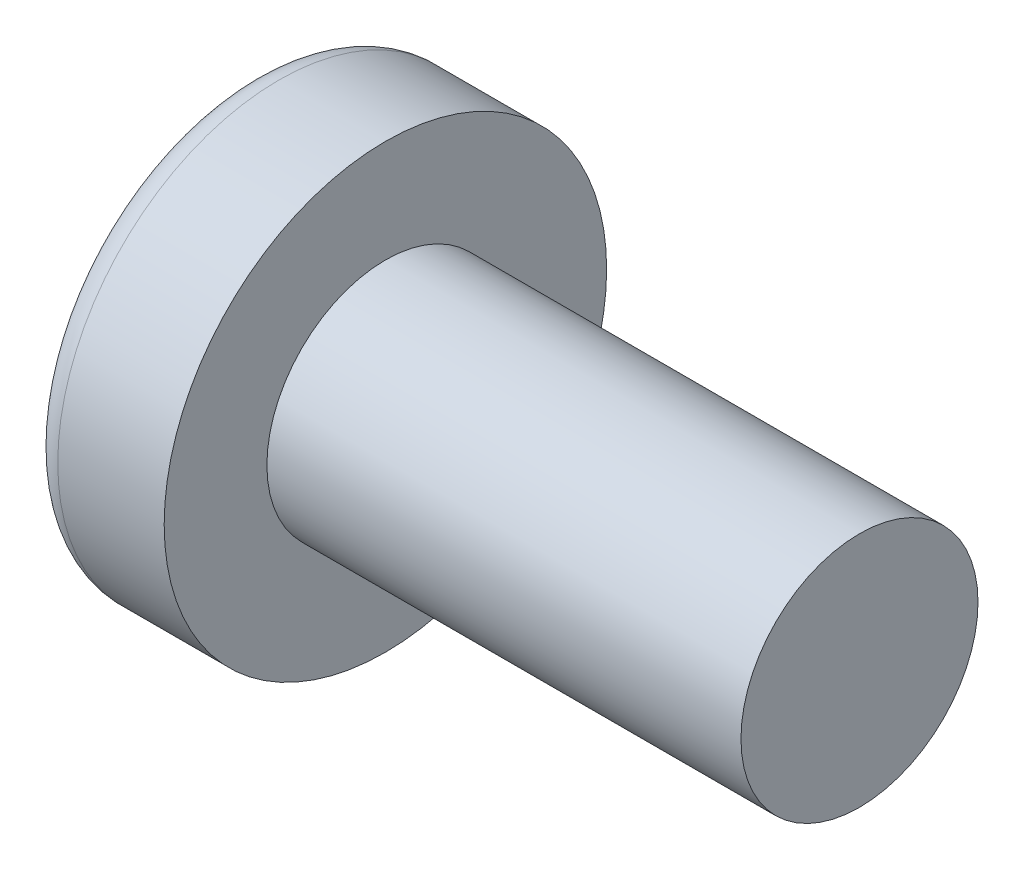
SolidWorks part; units mm, degrees
ref_plane "Plane1" through (0, 0, 0) normal (0, 0, 1) x (1, 0, 0)
ref_plane "Plane2" through (0, 0, 0) normal (0, 1, 0) x (1, 0, 0)
ref_plane "Plane3" through (0, 0, 0) normal (1, 0, 0) x (0, 0, -1)
revolve "Base-Revolve" add sketch "BodySke" angle 360 about L2
sketch "BodySke" plane through (0, 0, 0) normal (0, 0, 1) x (1, 0, 0)
  line L0 (2.4, 1.5) -> (2.4, 2.8)
  line L1 (2.9, 6.35) -> (2.9, -3.175) construction
  line L2 (-25.4, 0) -> (127, 0) construction
  line L3 (8.4, 0) -> (0, 0)
  line L4 (2.4, 1.5) -> (8.4, 1.5)
  line L5 (8.4, 1.5) -> (8.4, 0)
  line L6 (1.0534, 2.8) -> (2.4, 2.8)
  line L7 (2.4, -1.5) -> (8.4, -1.5) construction
  line L8 (2.4, 6.35) -> (2.4, -3.175) construction
  arc A0 (0.7472, 2.6293) -> (0, 0) centre (5, 0) ccw
  arc A2 (0.7472, 2.6293) -> (1.0534, 2.8) centre (1.0534, 2.44) cw
  dimension "Head_fillet_rad" = 0.36
  dimension "Head_crown_rad" = 5
  dimension "Head_ht" = 2.4
  dimension "Diameter" = 3
  dimension "Length" = 6
  dimension "Head_dia" = 5.6
  dimension "Advance" = 0.5
  dimension "Thread_nom" = 6
sketch "Sketch3" plane through (0, 0, 0) normal (1, 0, 0) x (0, 0, -1)
  line L0 (0.37, -1.45) -> (-0.37, -1.45)
  line L1 (0.37, -1.45) -> (0.37, 1.45)
  line L2 (-0.37, 1.45) -> (0.37, 1.45)
  line L3 (-0.37, 1.45) -> (-0.37, -1.45)
  dimension "D1" = 1.45
  dimension "Cross_dia" = 2.9
  dimension "D2" = 0.37
  dimension "Cross_width" = 0.74
ref_plane "Plane4" through (1.76, 0, 0) normal (1, 0, 0) x (0, 0, -1)
sketch "Sketch4" plane through (1.76, 0, 0) normal (1, 0, 0) x (0, 0, -1)
  line L0 (0.185, -0.185) -> (-0.185, -0.185)
  line L1 (0.185, -0.185) -> (0.185, 0.185)
  line L2 (-0.185, 0.185) -> (0.185, 0.185)
  line L3 (-0.185, 0.185) -> (-0.185, -0.185)
  dimension "D1" = 0.37
  dimension "D2" = 0.37
  dimension "D3" = 0.185
  dimension "D4" = 0.185
loft "Cut-Loft1" cut profiles "Sketch3", "Sketch4"
pattern_circular "CirPattern1" count 2 every 90 about axis through (0, 0, 0) along (1, 0, 0) of "Cut-Loft1"
equation "\"D1@Sketch3\" = \"Cross_dia@Sketch3\" / 2"
equation "\"D2@Sketch3\" = \"Cross_width@Sketch3\" / 2"
equation "\"D1@Sketch4\" = \"Cross_width@Sketch3\" *.5"
equation "\"D2@Sketch4\" = \"D1@Sketch4\""
equation "\"D3@Sketch4\" = \"D1@Sketch4\" / 2"
equation "\"D4@Sketch4\" = \"D2@Sketch4\" / 2"
equation "\"Thread_length@ThreadCosmetic\" = ((sgn( (\"Length@BodySke\" - \"Advance@BodySke\" ) - \"Thread_nom@BodySke\" )-1)*( (\"Length@BodySke\" - \"Advance@BodySke\" ) - \"Thread_nom@BodySke\" ))/-2+ \"Thread_nom@BodySke\""
